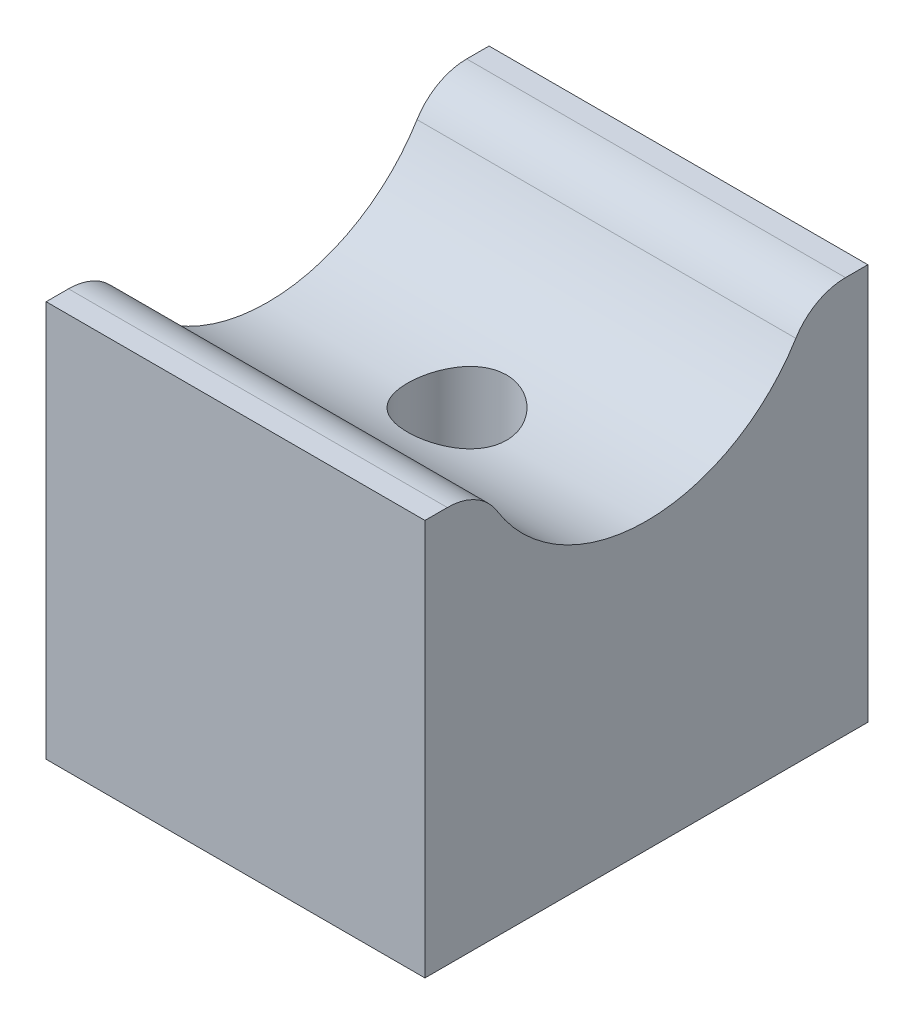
SolidWorks part; units mm, degrees
ref_plane "Vorne" through (0, 0, 0) normal (0, 0, 1) x (1, 0, 0)
ref_plane "Oben" through (0, 0, 0) normal (0, 1, 0) x (1, 0, 0)
ref_plane "Rechts" through (0, 0, 0) normal (1, 0, 0) x (0, 0, -1)
sketch "Skizze2" plane through (0, 0, 0) normal (0, 1, 0) x (1, 0, 0)
  line L1 (-16.25, 19) -> (16.25, 19)
  line L2 (-16.25, 19) -> (-16.25, -19)
  line L3 (-16.25, -19) -> (16.25, -19)
  line L4 (16.25, 19) -> (16.25, -19)
  line L5 (-16.25, 19) -> (16.25, -19) construction
  line L6 (-16.25, -19) -> (16.25, 19) construction
  point P0 (0, 0)
  dimension "D1" = 38
  dimension "D2" = 32.5
extrude "Grundkörper" add sketch "Skizze2" along normal blind 34
sketch "Skizze3" plane through (0, 0, 0) normal (1, 0, 0) x (0, 0, -1)
  line L0 (0, 0) -> (0, 39.5) construction
  circle A0 centre (0, 39.5) radius 15.05
  dimension "D1" = 15.05
  dimension "D2" = 39.5
extrude "Schnitt-Linear austragen1" cut sketch "Skizze3" against normal through all and the other way through all
fillet "Verrundung1" radius 5 2 edges at (0, 34, 14.009) (0, 34, -14.009)
hole_wizard "Stirnsenkung für M8 Zylinderschraube mit Innensechskant1" positions "Skizze5" profile "Skizze4" counterbore size "M8" standard "DIN"
sketch "Skizze5" plane through (0, 0, 0) normal (0, -1, 0) x (1, 0, 0)
  point P0 (0, 0)
sketch "Skizze4" plane through (0, 0, 0) normal (1, 0, 0) x (0, 0, -1)
  line L0 (0, 0) -> (0, 34)
  line L1 (0, 34) -> (4.25, 34)
  line L3 (4.25, 34) -> (4.25, 2)
  line L4 (4.25, 2) -> (7.5067, 2)
  line L5 (7.5067, 2) -> (7.5067, 0)
  line L7 (7.5067, 0) -> (0, 0)
  line L11 (0, -6.35) -> (0, 107.95) construction
  dimension "Bohrerdurchmesser" = 8.5
  dimension "Bohrungstiefe" = 34
  dimension "Senkdurchmesser2" = 15.0135
  dimension "Senktiefe2" = 2
